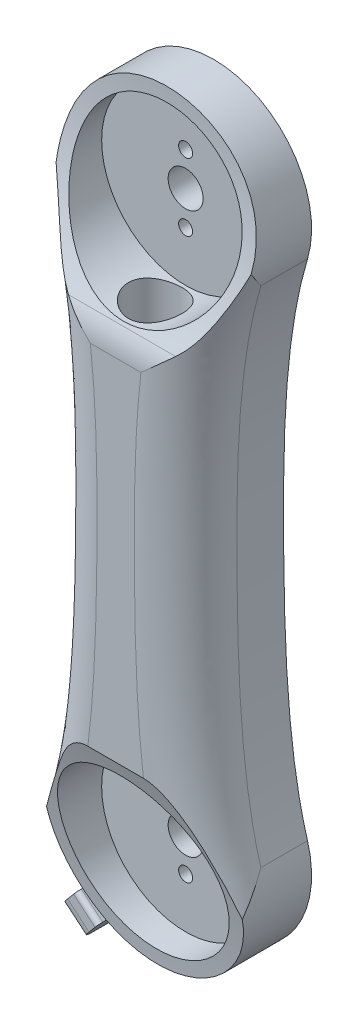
SolidWorks part; units mm, degrees
ref_plane "Front Plane" through (0, 0, 0) normal (0, 0, 1) x (1, 0, 0)
ref_plane "Top Plane" through (0, 0, 0) normal (0, 1, 0) x (1, 0, 0)
ref_plane "Right Plane" through (0, 0, 0) normal (1, 0, 0) x (0, 0, -1)
sketch "Sketch1" plane through (0, 0, 0) normal (0, 0, 1) x (1, 0, 0)
  circle A0 centre (0, 0) radius 21
  circle A1 centre (0, 120) radius 21
  dimension "D1" = 42
  dimension "D2" = 42
  dimension "D3" = 120
extrude "Boss-Extrude2" add sketch "Sketch1" along normal blind 5 contours A1 | A0
sketch "Sketch5" plane through (0, 0, 5) normal (0, 0, 1) x (1, 0, 0)
  line L0 (-21, 120) -> (-21, 0)
  line L1 (21, 0) -> (21, 120)
  line L2 (0, 120) -> (0, 107.3475) construction
  circle A0 centre (0, 120) radius 21 construction
  circle A1 centre (0, 120) radius 21
  circle A2 centre (0, 120) radius 21
  circle A3 centre (0, 0) radius 21
  circle A4 centre (0, 0) radius 21
  spline S0 degree 3 poles (-20.1246, 114) (-15.3066, 97.84) (-14.4592, 60.7855) (-15.775, 20.589) (-20.1246, 6) knots 0 0 0 0 0.5 1 1 1 1
  spline S1 degree 3 poles (20.1246, 114) (15.3066, 97.84) (14.4592, 60.7855) (15.775, 20.589) (20.1246, 6) knots 0 0 0 0 0.5 1 1 1 1
  dimension "D3" = 60
  dimension "D4" = 15
  dimension "D5" = 6
  dimension "D1" = 0
  dimension "D2" = 0
extrude "Boss-Extrude5" add sketch "Sketch5" along normal blind 16 contours A4 L1 L0 M3 | M3 | A4
sketch "Sketch7" plane through (0, 0, 0) normal (1, 0, 0) x (0, 0, -1)
  line L0 (-21, 141) -> (-10, 141)
  line L1 (-21, 60) -> (-12, 60) construction
  line L3 (-21, 114) -> (-21, 6) construction
  line L6 (-21, -21) -> (0, -21) construction
  line L10 (-21, 141) -> (-21, -21)
  line L11 (-21, 6) -> (-21, -21) construction
  line L12 (-21, -21) -> (-10, -21)
  spline S0 degree 2 poles (-10, 141) (-9.6461, 118.018) (-21, 99) knots 0 0 0 1 1 1
  spline S1 degree 2 poles (-21, 21) (-13.6469, 0.6509) (-12, -21) knots 0 0 0 1 1 1
  dimension "D2" = 9
  dimension "D3" = 42
  dimension "D4" = 42
  dimension "D5" = 5
  dimension "D9" = 5
  dimension "D10" = 11
extrude "Cut-Extrude2" cut sketch "Sketch7" against normal through all both and the other way through all
ref_plane "Plane1" through (0, 0, 6) normal (0, 0, -1) x (-1, 0, 0)
sketch "Sketch8" plane through (0, 0, 6) normal (0, 0, -1) x (-1, 0, 0)
  circle A2 centre (0, 120) radius 18
  circle A3 centre (0, 120) radius 18
  circle A5 centre (0, 0) radius 18
  circle A6 centre (0, 0) radius 18
  dimension "D1" = 3
  dimension "D2" = 3
extrude "Cut-Extrude3" cut sketch "Sketch8" against normal through all
fillet "Fillet1" radius 11 3 edges at (0, 99, 21)
sketch "Sketch9" plane through (0, 0, 5) normal (0, 0, -1) x (-1, 0, 0)
  arc A2 (-20.1246, 114) -> (20.1246, 114) centre (0, 120) ccw
  arc A3 (20.1246, 6) -> (-20.1246, 6) centre (0, 0) ccw
  arc A4 (-20.1246, 114) -> (20.1246, 114) centre (0, 120) ccw
  arc A5 (20.1246, 6) -> (-20.1246, 6) centre (0, 0) ccw
  spline S2 degree 3 poles (-2885.2239, -736.845) (-56.0352, 342.2809) (23.0939, 135.7734) (-50.2691, -292.2216) (-1649.1546, 2517.7242) knots -3.964927 -3.964927 -3.964927 -3.964927 0.5 4.43094 4.43094 4.43094 4.43094 only from (-20.1246, 114) to (-20.1246, 6)
  spline S3 degree 3 poles (1649.1463, 2517.7096) (50.269, -292.2209) (-23.0936, 135.7723) (56.0347, 342.2796) (2885.176, -736.8267) knots -3.430933 -3.430933 -3.430933 -3.430933 0.5 4.964902 4.964902 4.964902 4.964902 only from (20.1246, 6) to (20.1246, 114)
  spline S4 degree 3 poles (-20.1246, 114) (-15.3066, 97.84) (-14.4592, 60.7855) (-15.775, 20.589) (-20.1246, 6) knots 0 0 0 0 0.5 1 1 1 1
  spline S5 degree 3 poles (20.1246, 6) (15.775, 20.589) (14.4592, 60.7855) (15.3066, 97.84) (20.1246, 114) knots 0 0 0 0 0.5 1 1 1 1
  dimension "D1" = 0
extrude "Boss-Extrude6" add sketch "Sketch9" along normal up to surface (5 mm away)
sketch "Sketch10" plane through (0, 0, 0) normal (0, 1, 0) x (1, 0, 0)
  line L2 (21, 0) -> (-21, 0) construction
  circle A0 centre (0, -12.5) radius 5.75
  dimension "D1" = 11.5
  dimension "D2" = 12.5
extrude "Cut-Extrude4" cut sketch "Sketch10" along normal blind 114
ref_plane "Plane2" through (-13.4985, -16.0869, 0) normal (-0.6428, -0.766, 0) x (0, 0, -1)
sketch "Sketch11" plane through (-13.4985, -16.0869, 0) normal (-0.6428, -0.766, 0) x (0, 0, -1)
  line L0 (0, -3) -> (0, 3)
  line L1 (-11, 3) -> (0, 3)
  line L2 (-11, 3) -> (-11, -3)
  line L3 (-11, -3) -> (0, -3)
  line L6 (0, -19.2731) -> (0, 21) construction
  dimension "D1" = 6
  dimension "D3" = 11
  dimension "D4" = 3
extrude "Boss-Extrude7" add sketch "Sketch11" along normal blind 10 and the other way up to surface separate body
sketch "Sketch12" plane through (-2.2981, 1.9284, 0) normal (-0.766, 0.6428, 0) x (0, 0, 1)
  line L5 (4, -22.7846) -> (4, -27)
  line L7 (4, -27) -> (8, -27)
  line L8 (8, -27) -> (8, -25)
  line L9 (8, -25) -> (11, -25)
  line L10 (11, -31) -> (11, -20.7846) construction
  line L11 (11, -22.7846) -> (11, -25)
  line L16 (4, -22.7846) -> (11, -22.7846)
  line L17 (11, -20.7846) -> (0, -20.7846) construction
  line L19 (11, -31) -> (0, -31) construction
  line L20 (0, -31) -> (0, -20.7846) construction
  dimension "D1" = 2
  dimension "D2" = 4
  dimension "D3" = 2
  dimension "D4" = 4
  dimension "D5" = 4
extrude "Cut-Extrude5" cut sketch "Sketch12" against normal up to next
fillet "Fillet5" radius 3 2 edges at (-19.9264, -23.7474, 0) (-19.9264, -23.7474, 11)
fillet "Fillet6" radius 1 4 edges at (-16.0697, -19.1511, 11) (-16.0697, -19.1511, 8) (-17.3553, -20.6832, 4) (-17.3553, -20.6832, 8)
sketch "Sketch13" plane through (0, 0, 6) normal (0, 0, 1) x (1, 0, 0)
  circle A0 centre (0, 7.25) radius 1.5
  circle A1 centre (0, -7.25) radius 1.5
  circle A2 centre (0, 0) radius 3.75
  dimension "D1" = 3
  dimension "D2" = 3
  dimension "D5" = 7.5
  dimension "D3" = 14.5
  dimension "D4" = 7.25
extrude "Cut-Extrude6" cut sketch "Sketch13" against normal up to next
sketch "Sketch14" plane through (0, 0, 6) normal (0, 0, 1) x (1, 0, 0)
  line L0 (0, 120) -> (0, 131.2158) construction
  circle A0 centre (0, 127.25) radius 1.5
  circle A1 centre (0, 112.75) radius 1.5
  circle A2 centre (0, 120) radius 3.75
  dimension "D1" = 3
  dimension "D2" = 3
  dimension "D5" = 7.5
  dimension "D3" = 14.5
  dimension "D4" = 7.25
extrude "Cut-Extrude7" cut sketch "Sketch14" against normal up to next
fillet "Fillet7" radius 1 1 edges at (-14.6457, -17.454, 11)
